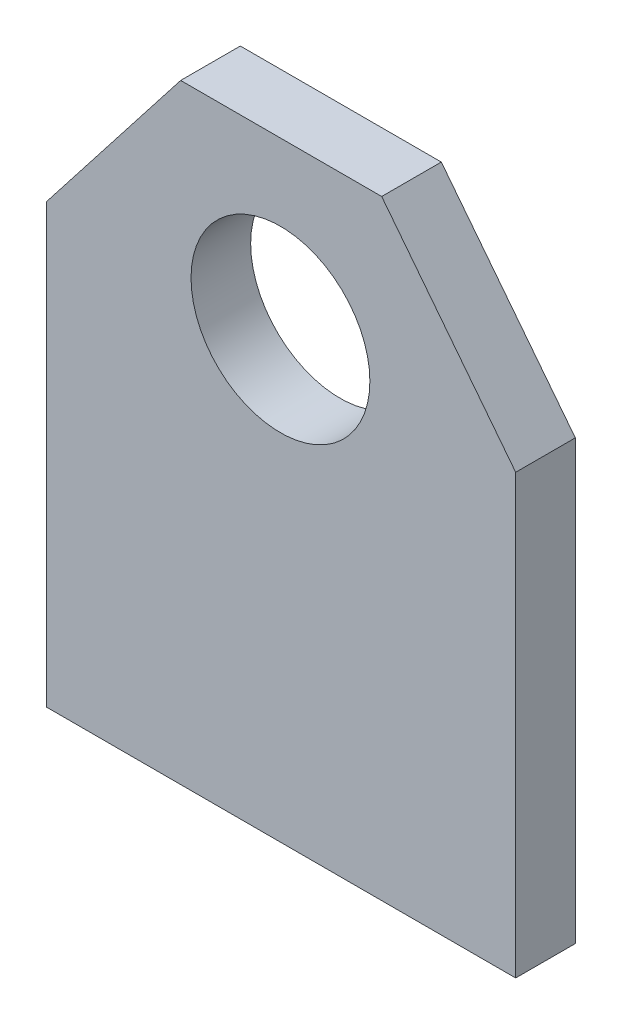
SolidWorks part; units mm, degrees
ref_plane "Front Plane" through (0, 0, 0) normal (0, 0, 1) x (1, 0, 0)
ref_plane "Top Plane" through (0, 0, 0) normal (0, 1, 0) x (1, 0, 0)
ref_plane "Right Plane" through (0, 0, 0) normal (1, 0, 0) x (0, 0, -1)
sketch "Skizze1" plane through (0, 0, 0) normal (0, 0, 1) x (1, 0, 0)
  line L0 (0, 0) -> (-65.9291, 0)
  line L1 (-18.837, 85.7239) -> (-47.092, 85.7239)
  line L2 (0, 0) -> (0, 61.5673)
  line L3 (-47.092, 85.7239) -> (-65.9291, 61.5673)
  line L4 (-65.9291, 0) -> (-65.9291, 61.5673)
  line L5 (-18.837, 85.7239) -> (0, 61.5673)
  line L6 (-32.9645, 0) -> (-32.9645, 114.4274) construction
  point P10 (-32.9645, 85.7239)
extrude "Linear austragen1" add sketch "Skizze1" along normal blind 8.382
sketch "Skizze2" plane through (0, 0, 8.382) normal (0, 0, 1) x (1, 0, 0)
  circle A0 centre (-33.0691, 62.4157) radius 12.5705
extrude "Linear austragen2" cut sketch "Skizze2" against normal through all
